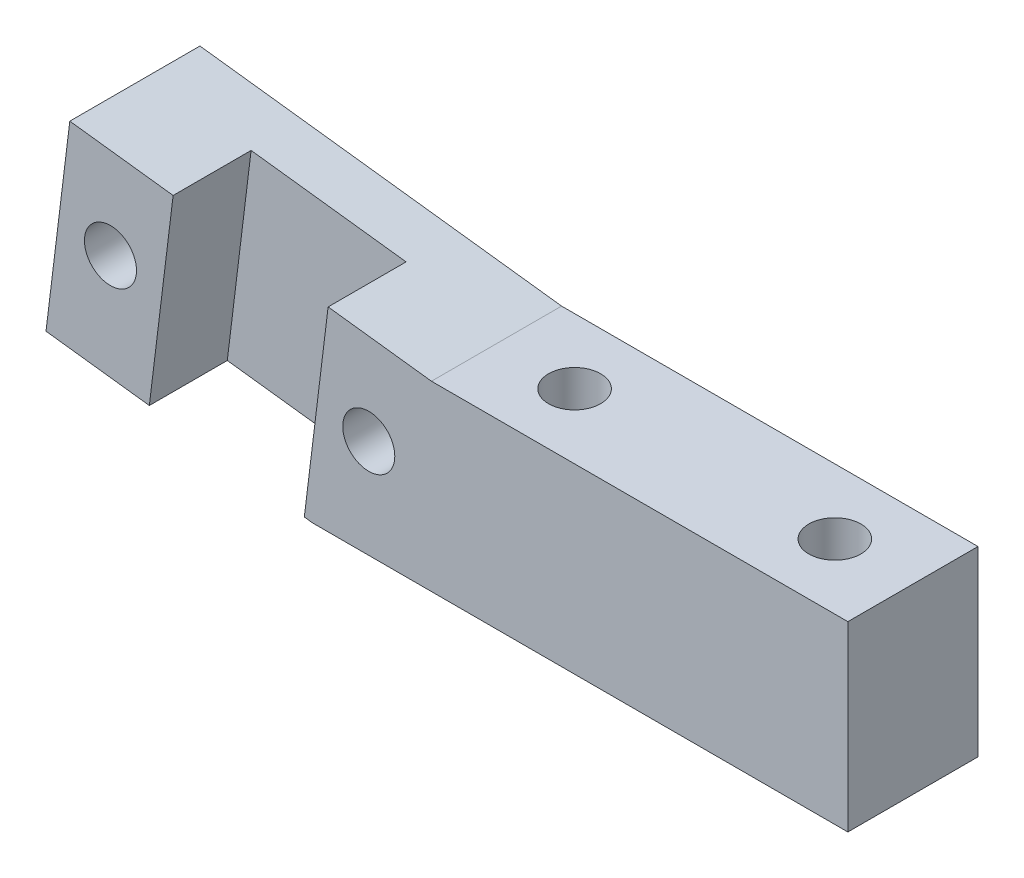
SolidWorks part; units mm, degrees
ref_plane "Front Plane" through (0, 0, 0) normal (0, 0, 1) x (1, 0, 0)
ref_plane "Top Plane" through (0, 0, 0) normal (0, 1, 0) x (1, 0, 0)
ref_plane "Right Plane" through (0, 0, 0) normal (1, 0, 0) x (0, 0, -1)
sketch "Sketch1" plane through (0, 0, 0) normal (0, 0, 1) x (1, 0, 0)
  line L0 (0, 0) -> (71.5257, 0) construction
  line L1 (0, 0) -> (-62.8375, 7.7155) construction
  line L2 (0, 11.1125) -> (50.8, 11.1125)
  line L3 (50.8, 11.1125) -> (50.8, -11.1125)
  line L4 (50.8, -11.1125) -> (-14.4898, -11.1125)
  line L5 (9.525, 11.1125) -> (9.525, 0)
  line L6 (9.525, 0) -> (9.525, -11.1125)
  line L7 (41.275, 11.1125) -> (41.275, 0)
  line L8 (41.275, 0) -> (41.275, -11.1125)
  line L9 (0, 11.1125) -> (-44.1187, 16.5296)
  line L11 (-14.4898, -11.1125) -> (-47.0222, -7.118)
  line L12 (-47.0222, -7.118) -> (-44.1187, 16.5296)
  line L13 (-12.6053, 12.6602) -> (-15.5089, -10.9874)
  line L14 (-31.5133, 14.9819) -> (-34.4169, -8.6658)
  circle A0 centre (-39.1602, 4.8083) radius 3.175
  circle A1 centre (-7.6468, 0.9389) radius 3.175
  dimension "D15" = 6.35
  dimension "D1" = 7
  dimension "D2" = 22.225
  dimension "D3" = 44.45
  dimension "D4" = 12.7
  dimension "D5" = 19.05
  dimension "D6" = 12.7
  dimension "D7" = 23.8252
  dimension "D8" = 27.6421
  dimension "D9" = 50.8
  dimension "D10" = 9.525
  dimension "D11" = 9.525
  dimension "D12" = 31.75
  dimension "D13" = 6.35
  dimension "D14" = 6.35
sketch "Sketch2" plane through (0, 0, 0) normal (0, 0, 1) x (1, 0, 0)
  line L0 (50.8, -11.1125) -> (-14.4898, -11.1125) construction
  line L1 (-14.4898, -11.1125) -> (-47.0222, -7.118) construction
  line L2 (-47.0222, -7.118) -> (-44.1187, 16.5296) construction
  line L3 (0, 11.1125) -> (-44.1187, 16.5296) construction
  line L4 (0, 11.1125) -> (50.8, 11.1125) construction
  line L5 (50.8, 11.1125) -> (50.8, -11.1125) construction
  line L6 (50.8, -11.1125) -> (-14.4898, -11.1125)
  line L7 (-14.4898, -11.1125) -> (-47.0222, -7.118)
  line L8 (-47.0222, -7.118) -> (-44.1187, 16.5296)
  line L9 (0, 11.1125) -> (-44.1187, 16.5296)
  line L10 (0, 11.1125) -> (50.8, 11.1125)
  line L11 (50.8, 11.1125) -> (50.8, -11.1125)
  circle A0 centre (-7.6468, 0.9389) radius 3.175 construction
  circle A1 centre (-39.1602, 4.8083) radius 3.175 construction
  circle A2 centre (-7.6468, 0.9389) radius 3.175
  circle A3 centre (-39.1602, 4.8083) radius 3.175
extrude "Boss-Extrude1" add sketch "Sketch2" along normal mid plane 15.875
sketch "Sketch3" plane through (0, 0, 0) normal (0, 0, 1) x (1, 0, 0)
  line L0 (-14.4898, -11.1125) -> (-47.0222, -7.118) construction
  line L1 (-12.6053, 12.6602) -> (-15.5089, -10.9874) construction
  line L2 (0, 11.1125) -> (-44.1187, 16.5296) construction
  line L3 (-31.5133, 14.9819) -> (-34.4169, -8.6658) construction
  line L4 (-15.5089, -10.9874) -> (-34.4169, -8.6658)
  line L5 (-12.6053, 12.6602) -> (-15.5089, -10.9874)
  line L6 (-12.6053, 12.6602) -> (-31.5133, 14.9819)
  line L7 (-31.5133, 14.9819) -> (-34.4169, -8.6658)
extrude "Cut-Extrude1" cut sketch "Sketch3" along normal blind 15.875 from offset 1.5748
sketch "Sketch4" plane through (0, 0, 0) normal (0, 1, 0) x (1, 0, 0)
  circle A0 centre (9.525, 0) radius 3.175
  circle A1 centre (41.275, 0) radius 3.175
  dimension "D1" = 6.35
extrude "Cut-Extrude2" cut sketch "Sketch4" against normal mid plane 50.8
